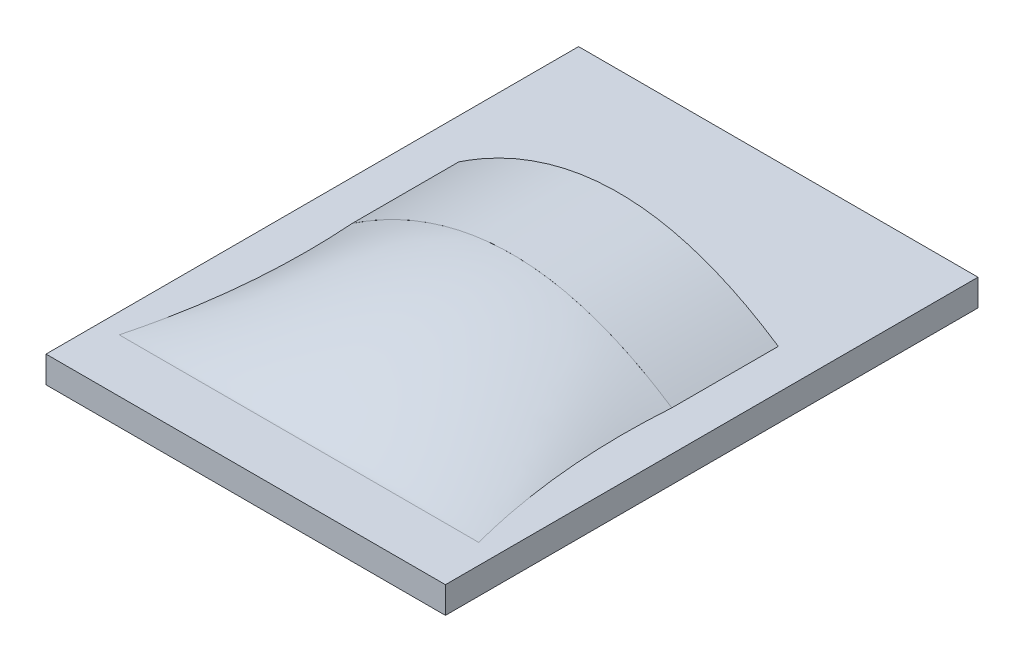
SolidWorks part; units mm, degrees
ref_plane "Ebene vorne" through (0, 0, 0) normal (0, 0, 1) x (1, 0, 0)
ref_plane "Ebene oben" through (0, 0, 0) normal (0, 1, 0) x (1, 0, 0)
ref_plane "Ebene rechts" through (0, 0, 0) normal (1, 0, 0) x (0, 0, -1)
sketch "Skizze1" plane through (0, 0, 0) normal (0, 0, 1) x (1, 0, 0)
  line L0 (0, 63.5132) -> (0, -39.9482) construction
  spline S0 degree 2 poles (-60, 0) (0, 40) (60, 0) knots 0 0 0 1 1 1
  dimension "D1" = 60
  dimension "D2" = 20
sketch "Skizze2" plane through (0, 0, 0) normal (0, 1, 0) x (1, 0, 0)
  line L1 (-75, 100) -> (75, 100)
  line L2 (-75, 100) -> (-75, -100)
  line L3 (-75, -100) -> (75, -100)
  line L4 (75, 100) -> (75, -100)
  line L5 (-75, 100) -> (75, -100) construction
  line L6 (-75, -100) -> (75, 100) construction
  point P0 (0, 0)
  dimension "D1" = 200
  dimension "D2" = 150
extrude "Aufsatz-Linear austragen1" add sketch "Skizze2" against normal blind 10
sketch "Skizze3" plane through (0, 0, 0) normal (0, 1, 0) x (1, 0, 0)
  line L0 (-67.5, -80) -> (67.5, -80)
  dimension "D1" = 135
  dimension "D2" = 80
  dimension "D3" = 67.5
sketch "Skizze4" plane through (0, 0, 0) normal (0, 1, 0) x (1, 0, 0)
  line L0 (-60, 0) -> (60, 0) construction
  spline S0 degree 2 poles (-60, 0) (-57.123, -40.5485) (-67.5, -80) knots 0 0 0 1 1 1
  spline S1 degree 2 poles (60, 0) (57.123, -40.5485) (67.5, -80) knots 0 0 0 1 1 1
  dimension "D1" = 35
  dimension "D2" = 35
  dimension "D3" = 60
  dimension "D4" = 60
sketch "Skizze5" plane through (0, 0, 0) normal (0, 1, 0) x (1, 0, 0)
  line L0 (-60, 0) -> (60, 0) construction
  line L1 (-60, 0) -> (60, 0)
sketch "Skizze6" plane through (0, 0, 0) normal (0, 0, 1) x (1, 0, 0)
  line L0 (-60, 0) -> (60, 0) construction
  line L1 (-60, 0) -> (60, 0)
  parabola Q0 construction
  parabola Q1
extrude "Aufsatz-Linear austragen2" add sketch "Skizze6" against normal blind 40
surface "Oberfläche-Ausformung1"
